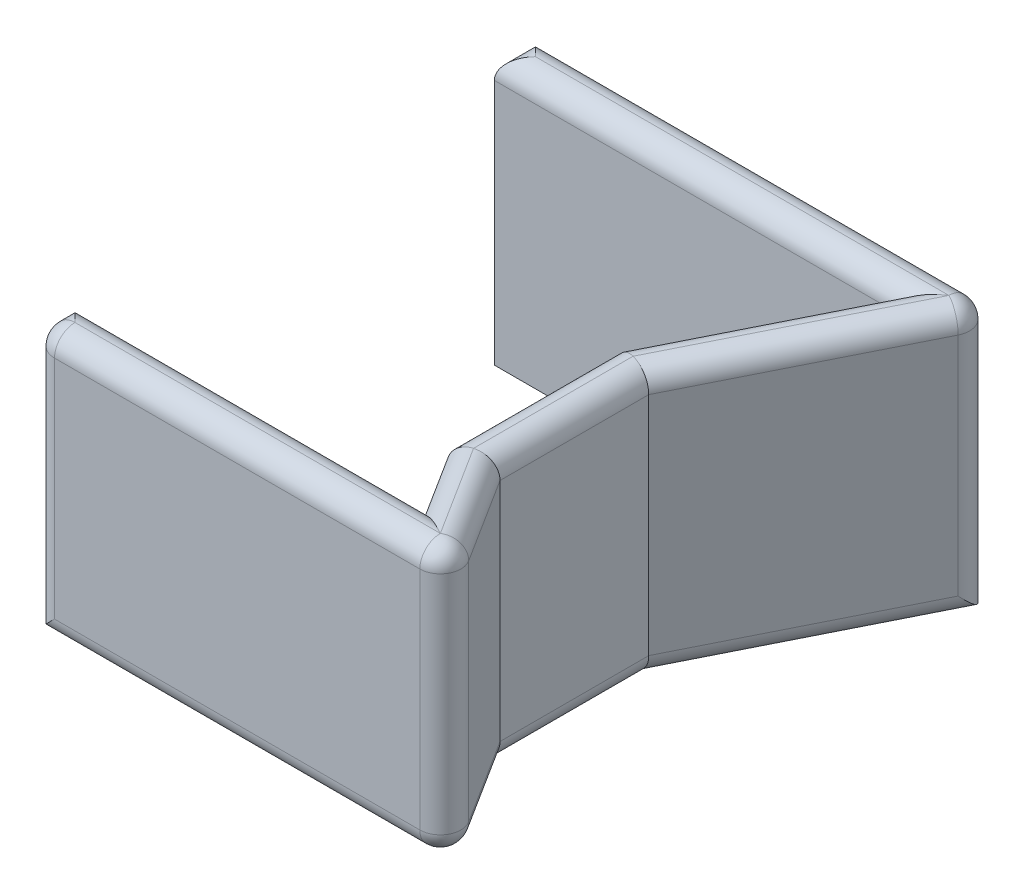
SolidWorks part; units mm, degrees
ref_plane "Front" through (0, 0, 0) normal (0, 0, 1) x (1, 0, 0)
ref_plane "Top" through (0, 0, 0) normal (0, 1, 0) x (1, 0, 0)
ref_plane "Right" through (0, 0, 0) normal (1, 0, 0) x (0, 0, -1)
sketch "Sketch1" plane through (0, 0, 0) normal (0, 1, 0) x (1, 0, 0)
  line L0 (-175.7575, 164.8993) -> (35.4803, 164.8993)
  line L1 (35.4803, 164.8993) -> (-15.748, 62.388)
  line L2 (-15.748, 62.388) -> (-15.748, -15.2415)
  line L3 (-15.748, -15.2415) -> (12.0356, -59.1694)
  line L4 (12.0356, -59.1694) -> (-175.7575, -59.1694)
extrude "Extrude-Thin1" add sketch "Sketch1" along normal blind 130 thin
fillet "Fillet1" radius 10 19 edges at (-62.0503, 130, -174.8993) (-175.7575, 130, -164.8993) (-78.2268, 130, -154.8993) (-3.2221, 130, -109.8234) (-25.748, 130, -23.3045) (-15.9347, 130, 33.654) (-90.9395, 130, 49.1694) (-175.7575, 130, 59.1694) (-72.7824, 130, 69.1694) (-175.7575, 65, 69.1694) (-72.7824, 0, 69.1694) (12.2224, 0, 40.757) (-5.748, 0, -23.8419) (22.9544, 0, -117.4638) (22.9544, 130, -117.4638) (-5.748, 130, -23.8419) (12.2224, 130, 40.757) (51.6568, 65, -174.8993) (30.1928, 65, 69.1694)
